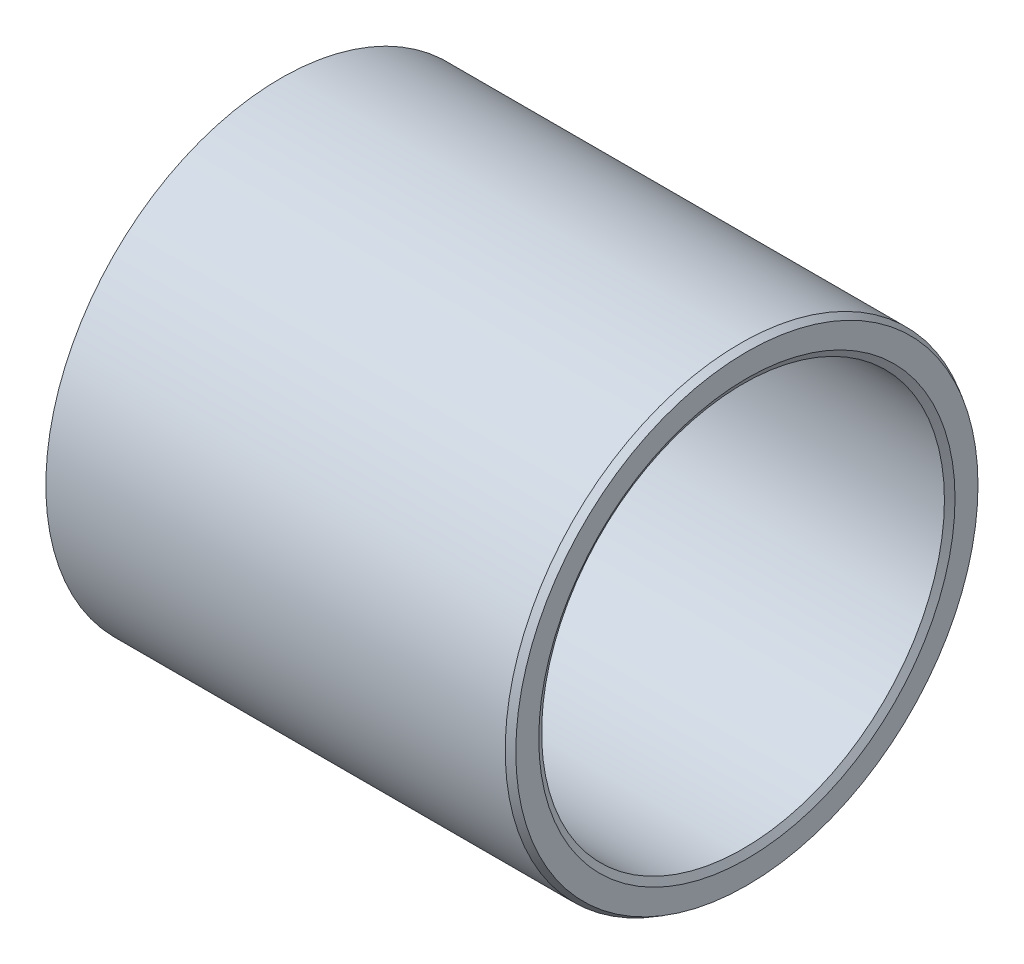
SolidWorks part; units mm, degrees
ref_plane "Front Plane" through (0, 0, 0) normal (0, 0, 1) x (1, 0, 0)
ref_plane "Top Plane" through (0, 0, 0) normal (0, 1, 0) x (1, 0, 0)
ref_plane "Right Plane" through (0, 0, 0) normal (1, 0, 0) x (0, 0, -1)
sketch "Sketch1" plane through (0, 0, 0) normal (1, 0, 0) x (0, 0, -1)
  circle A0 centre (0, 0) radius 3
  circle A1 centre (0, 0) radius 3.5
  dimension "D1" = 7
  dimension "D2" = 6
extrude "Boss-Extrude1" add sketch "Sketch1" along normal mid plane 7
chamfer "Chamfer1" distance 0.1 angle 30 4 edges at (-3.5, 0, -3) (-3.5, 0, -3.5) (3.5, 0, -3) (3.5, 0, -3.5)
